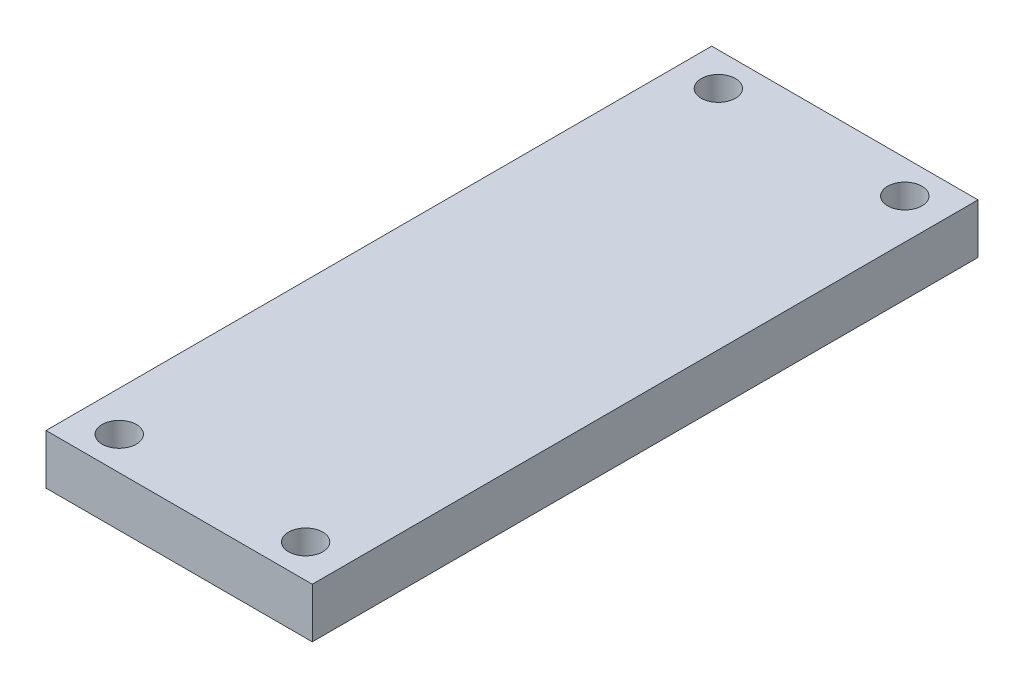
SolidWorks part; units mm, degrees
ref_plane "Front Plane" through (0, 0, 0) normal (0, 0, 1) x (1, 0, 0)
ref_plane "Top Plane" through (0, 0, 0) normal (0, 1, 0) x (1, 0, 0)
ref_plane "Right Plane" through (0, 0, 0) normal (1, 0, 0) x (0, 0, -1)
sketch "Sketch1" plane through (0, 0, 0) normal (0, 1, 0) x (1, 0, 0)
  line L1 (-12.7, 31.75) -> (12.7, 31.75)
  line L2 (-12.7, 31.75) -> (-12.7, -31.75)
  line L3 (-12.7, -31.75) -> (12.7, -31.75)
  line L4 (12.7, 31.75) -> (12.7, -31.75)
  dimension "D1" = 63.5
  dimension "D2" = 31.75
  dimension "D3" = 25.4
  dimension "D4" = 12.7
extrude "Extrude1" add sketch "Sketch1" along normal blind 4.7625
hole_wizard "#4 Clearance Hole1" positions "3DSketch2" profile "Sketch3" hole size "#4" standard "Ansi Inch"
sketch3d "3DSketch2"
  line L0 (-12.7, 4.7625, 31.75) -> (12.7, 4.7625, 31.75) construction
  line L1 (12.7, 4.7625, -31.75) -> (-12.7, 4.7625, -31.75) construction
  line L2 (-12.7, 4.7625, -31.75) -> (-12.7, 4.7625, 31.75) construction
  line L3 (12.7, 4.7625, 31.75) -> (12.7, 4.7625, -31.75) construction
  point P0 (-8.89, 4.7625, 28.575)
  point P2 (8.89, 4.7625, 28.575)
  point P4 (-8.89, 4.7625, -28.575)
  point P6 (8.89, 4.7625, -28.575)
  dimension "D1" = 3.175
  dimension "D2" = 3.175
  dimension "D3" = 3.81
  dimension "D4" = 3.81
sketch "Sketch3" plane through (-8.89, 4.7625, 28.575) normal (1, 0, 0) x (0, 0, 1)
  line L0 (0, 0) -> (0, 4.7625)
  line L1 (0, 4.7625) -> (1.6319, 4.7625)
  line L2 (1.6319, 4.7625) -> (1.6319, 0)
  line L5 (1.6319, 0) -> (0, 0)
  line L11 (0, -6.35) -> (0, 107.95) construction
  dimension "Thru Hole Dia." = 3.2639
  dimension "Thru Hole Depth" = 4.7625
